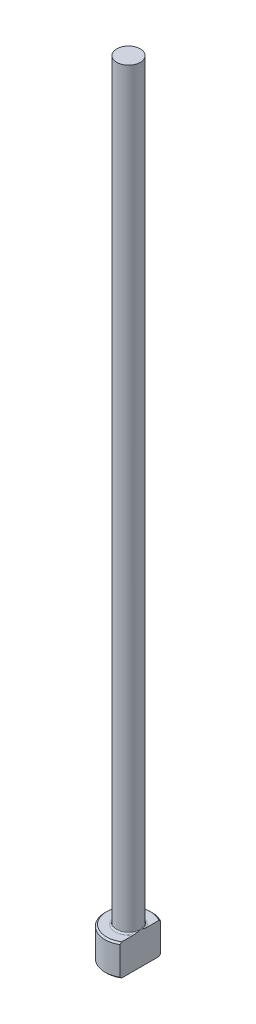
SolidWorks part; units mm, degrees
ref_plane "Front Plane" through (0, 0, 0) normal (0, 0, 1) x (1, 0, 0)
ref_plane "Top Plane" through (0, 0, 0) normal (0, 1, 0) x (1, 0, 0)
ref_plane "Right Plane" through (0, 0, 0) normal (1, 0, 0) x (0, 0, -1)
sketch "Sketch1" plane through (0, 0, 0) normal (0, 0, 1) x (1, 0, 0)
  line L0 (0, 259.9588) -> (0, -15.1925) construction
  line L1 (0, 0) -> (-3, 0)
  line L2 (-3, 0) -> (-3, 4)
  line L3 (-3, 4) -> (-1.5, 4)
  line L4 (-1.5, 4) -> (-1.5, 100)
  line L5 (-1.5, 100) -> (0, 100)
  line L6 (0, 100) -> (0, 0)
  dimension "L" = 100
  dimension "H" = 6
  dimension "T" = 4
  dimension "D" = 3
revolve "Revolve1" add sketch "Sketch1" angle 360 about L0
chamfer "Chamfer1" distance 0.2 angle 45 2 edges at (0, 4, 3) (0, 0, 3)
fillet "Fillet1" radius 0.2 1 edges at (0, 4, 1.5)
sketch "Sketch2" plane through (0, 0, 0) normal (0, 1, 0) x (1, 0, 0)
  line L0 (1.5, -2.5981) -> (1.5, 2.5981)
  circle A0 centre (0, 0) radius 3 construction
  arc A1 (1.5, -2.5981) -> (1.5, 2.5981) centre (0, 0) ccw
  circle A2 centre (0, 0) radius 1.5 construction
extrude "KEYED HEAD" cut sketch "Sketch2" along normal through all
